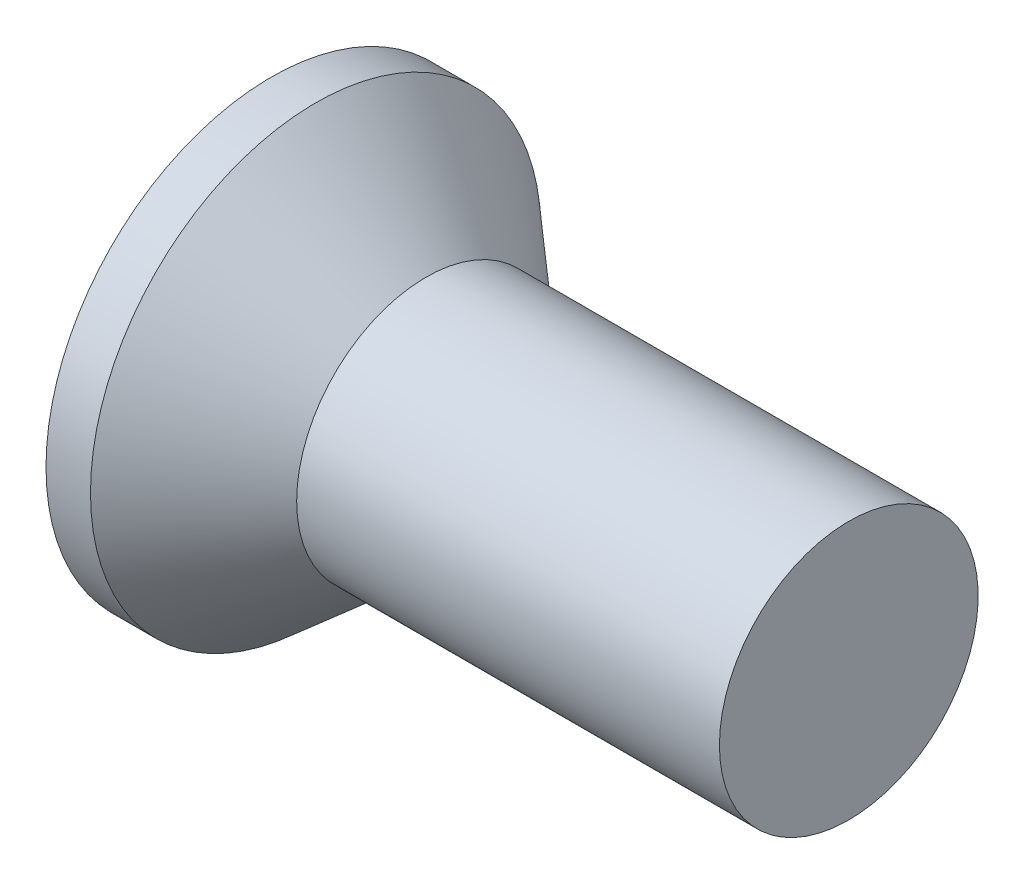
SolidWorks part; units mm, degrees
ref_plane "Plane1" through (0, 0, 0) normal (0, 0, 1) x (1, 0, 0)
ref_plane "Plane2" through (0, 0, 0) normal (0, 1, 0) x (1, 0, 0)
ref_plane "Plane3" through (0, 0, 0) normal (1, 0, 0) x (0, 0, -1)
sketch "BodySke" plane through (0, 0, 0) normal (0, 0, 1) x (1, 0, 0)
  line L0 (0, 0) -> (0, 2.4765)
  line L1 (0, 2.4765) -> (0.4892, 2.4765)
  line L2 (1.7018, 1.4224) -> (6.35, 1.4224)
  line L3 (6.35, 1.4224) -> (6.35, 0)
  line L4 (6.35, 0) -> (0, 0)
  line L5 (-6.35, 0) -> (82.55, 0) construction
  line L6 (1.7018, -1.4224) -> (6.35, -1.4224) construction
  line L7 (0.4892, -2.4765) -> (1.7018, -1.4224) construction
  line L8 (0.4892, 2.4765) -> (1.7018, 1.4224)
  line L9 (0, -2.4765) -> (0.4892, -2.4765) construction
  line L10 (2.3368, 3.0099) -> (2.3368, -6.5151) construction
  line L11 (0, 6.35) -> (0, -3.175) construction
  dimension "Diameter" = 2.8448
  dimension "Length" = 6.35
  dimension "Head_ht" = 1.7018
  dimension "Head_dia" = 4.953
  dimension "Head_ang" = 82
  dimension "D6" = 0.4892
  dimension "Advance" = 0.635
  dimension "Thread_nom" = 6.35
revolve "Base-Revolve" add sketch "BodySke" angle 360 about L5
sketch "Sketch2" plane through (0, 0, 0) normal (-1, 0, 0) x (0, 0, 1)
  line L0 (-2.4765, -0.4953) -> (2.4765, -0.4953)
  line L1 (-2.4765, -0.4953) -> (-2.4765, 0.4953)
  line L2 (2.4765, 0.4953) -> (-2.4765, 0.4953)
  line L3 (2.4765, 0.4953) -> (2.4765, -0.4953)
  dimension "D1" = 0.4953
  dimension "Slot_width" = 0.9906
  dimension "D2" = 4.953
  dimension "D3" = 2.4765
extrude "Slot" [suppressed] cut sketch "Sketch2" against normal blind 0.762
sketch "Sketch3" plane through (0, 0, 0) normal (-1, 0, 0) x (0, 0, 1)
  line L0 (-0.4064, 1.9939) -> (0.4064, 1.9939)
  line L1 (0.4064, 1.9939) -> (0.4064, -1.9939)
  line L2 (0.4064, -1.9939) -> (-0.4064, -1.9939)
  line L3 (-0.4064, -1.9939) -> (-0.4064, 1.9939)
  dimension "D1" = 1.9939
  dimension "Cross_dia" = 3.9878
  dimension "D2" = 0.4064
  dimension "Cross_width" = 0.8128
ref_plane "Plane4" through (2.2352, 0, 0) normal (-1, 0, 0) x (0, 0, 1)
sketch "Sketch4" plane through (2.2352, 0, 0) normal (-1, 0, 0) x (0, 0, 1)
  line L0 (-0.2032, 0.2032) -> (0.2032, 0.2032)
  line L3 (0.2032, 0.2032) -> (0.2032, -0.2032)
  line L4 (0.2032, -0.2032) -> (-0.2032, -0.2032)
  line L5 (-0.2032, -0.2032) -> (-0.2032, 0.2032)
  dimension "D1" = 0.4064
  dimension "D2" = 0.4064
  dimension "D3" = 0.2032
  dimension "D4" = 0.2032
loft "Cross" cut profiles "Sketch3", "Sketch4"
pattern_circular "CirPattern1" count 2 every 90 about axis through (0, 0, 0) along (1, 0, 0) of "Cross"
sketch "ThdSchSke" plane through (0, 0, 0) normal (0, 0, 1) x (1, 0, 0)
  line L0 (2.3368, -1.0439) -> (2.0718, -1.4224)
  line L1 (2.3368, -1.0439) -> (2.6018, -1.4224)
  line L2 (2.6018, -1.4224) -> (2.6018, -1.778)
  line L3 (-3.175, 0) -> (5.1513, 0) construction
  line L5 (2.6018, -1.778) -> (2.0718, -1.778)
  line L6 (2.0718, -1.778) -> (2.0718, -1.4224)
  line L7 (0, 2.4765) -> (0, -2.4765) construction
  dimension "Thread_minor" = 2.0879
  dimension "Diameter" = 2.8448
  dimension "Start" = 2.3368
  dimension "SideAngle" = 55
  dimension "VeeAngle" = 70
  dimension "Overcut" = 3.556
revolve "ThreadSchematic" [suppressed] cut sketch "ThdSchSke" angle 360 about L3
pattern_linear "ThdSchPat" [suppressed]
equation "\"D1@Sketch3\" = \"Cross_dia@Sketch3\" / 2"
equation "\"D2@Sketch3\" = \"Cross_width@Sketch3\" / 2"
equation "\"D1@Sketch4\" = \"Cross_width@Sketch3\" *.5"
equation "\"D2@Sketch4\" = \"D1@Sketch4\""
equation "\"D4@Sketch4\" = \"D2@Sketch4\" / 2"
equation "\"D3@Sketch4\" = \"D1@Sketch4\" / 2"
equation "\"D1@Sketch2\" = \"Slot_width@Sketch2\" / 2"
equation "\"D2@Sketch2\" = \"Head_dia@BodySke\""
equation "\"D3@Sketch2\" = \"D2@Sketch2\" / 2"
equation "\"Thread_length@ThreadCosmetic\" = ((sgn( (\"Length@BodySke\" - \"Advance@BodySke\" - \"Head_ht@BodySke\" ) - \"Thread_nom@BodySke\" )-1)*( (\"Length@BodySke\" - \"Advance@BodySke\" - \"Head_ht@BodySke\" ) - \"Thread_"
equation "\"Thread_minor@ThdSchSke\" = \"Thread_minor@ThreadCosmetic\""
equation "\"Diameter@ThdSchSke\" = \"Diameter@BodySke\""
equation "\"Overcut@ThdSchSke\" = \"Diameter@BodySke\" * 1.25"
equation "\"Start@ThdSchSke\" = 0.000001 + \"Length@BodySke\" - \"Thread_length@ThreadCosmetic\"  '---Countersunk---"
equation "\"Num_threads@ThdSchPat\" = int( \"Thread_length@ThreadCosmetic\" / \"Advance@BodySke\" + 0.999 )  + 1"
equation "\"Advance@ThdSchPat\" = \"Thread_length@ThreadCosmetic\" /  (\"Num_threads@ThdSchPat\" - 1) 'relax it"
